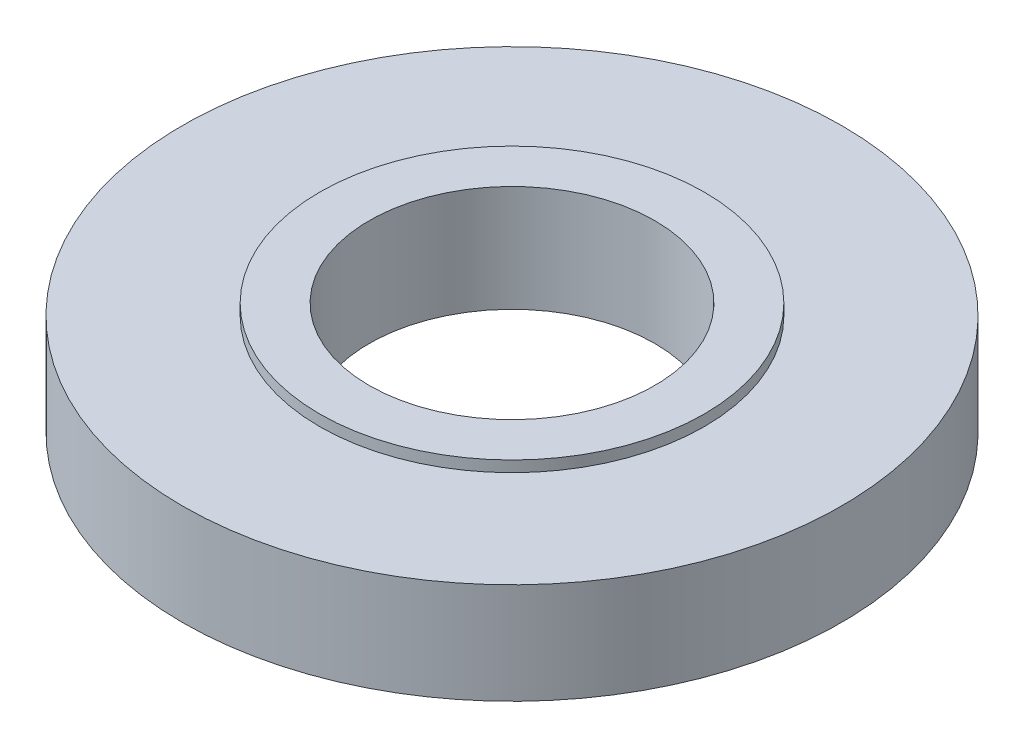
SolidWorks part; units mm, degrees
ref_plane "Piano frontale" through (0, 0, 0) normal (0, 0, 1) x (1, 0, 0)
ref_plane "Piano superiore" through (0, 0, 0) normal (0, 1, 0) x (1, 0, 0)
ref_plane "Piano destro" through (0, 0, 0) normal (1, 0, 0) x (0, 0, -1)
sketch "Schizzo1" plane through (0, 0, 0) normal (0, 0, 1) x (1, 0, 0)
  line L0 (0, 46.8919) -> (0, -27.5168) construction
  line L1 (17.5, 0) -> (13, 0)
  line L2 (17.5, 9.6876) -> (17.5, 8.6876)
  line L3 (17.5, 8.6876) -> (30, 8.6876)
  line L4 (30, 8.6876) -> (30, -0.5)
  line L5 (30, -0.5) -> (25.5, -0.5)
  line L6 (25.5, -0.5) -> (25.5, 0.5)
  line L7 (25.5, 0.5) -> (17.5, 0.5)
  line L8 (17.5, 0.5) -> (17.5, 0)
  line L10 (17.5, 9.6876) -> (13, 9.6876)
  line L11 (13, 9.6876) -> (13, 0)
  point P3 (17.5, 0.25)
  dimension "D1" = 30
  dimension "D2" = 17.5
  dimension "D3" = 13
  dimension "D4" = 9.1876
  dimension "D5" = 1
  dimension "D6" = 25.5
  dimension "D7" = 1
  dimension "D8" = 0.5
  dimension "D9" = 17.5
revolve "Rivoluzione1" add sketch "Schizzo1" angle 360 about L0
